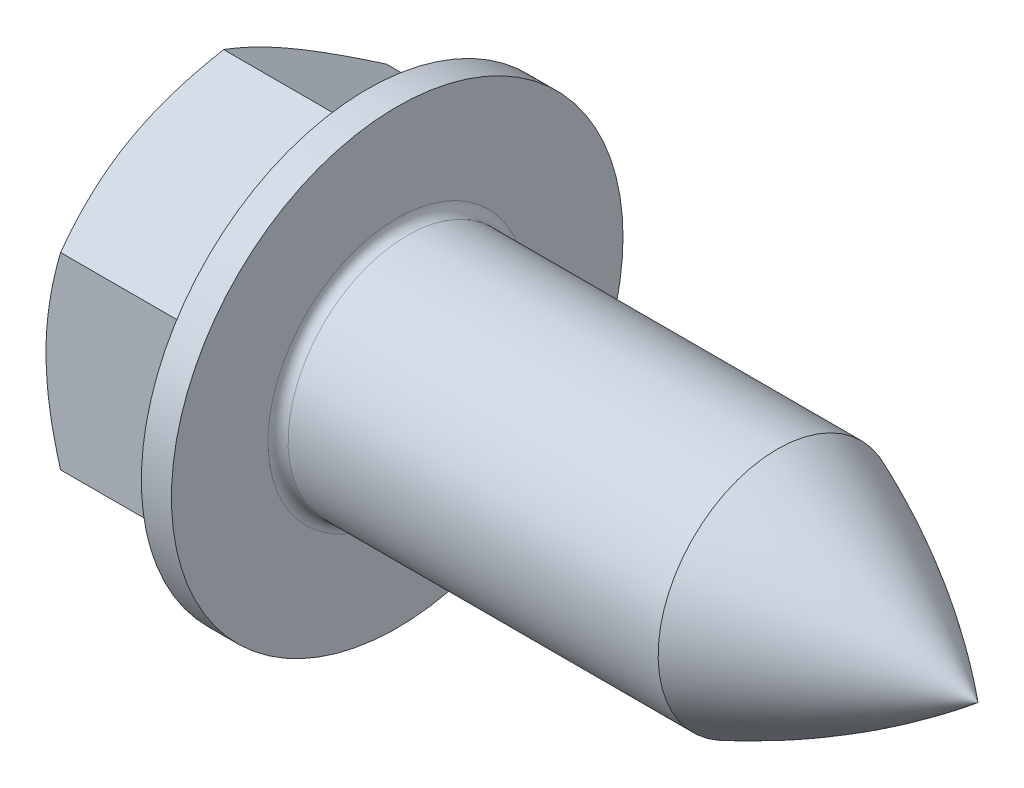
SolidWorks part; units mm, degrees
ref_plane "Front" through (0, 0, 0) normal (0, 0, 1) x (1, 0, 0)
ref_plane "Top" through (0, 0, 0) normal (0, 1, 0) x (1, 0, 0)
ref_plane "Right" through (0, 0, 0) normal (1, 0, 0) x (0, 0, -1)
sketch "Sketch2" plane through (0, 0, 0) normal (1, 0, 0) x (0, 0, -1)
  line L1 (0, 7.5056) -> (-6.5, 3.7528)
  line L2 (-6.5, 3.7528) -> (-6.5, -3.7528)
  line L3 (-6.5, -3.7528) -> (0, -7.5056)
  line L4 (0, -7.5056) -> (6.5, -3.7528)
  line L5 (6.5, -3.7528) -> (6.5, 3.7528)
  line L6 (6.5, 3.7528) -> (0, 7.5056)
  circle A0 centre (0, 0) radius 6.5 construction
  dimension "s" = 13
extrude "BaseHead" add sketch "Sketch2" along normal blind 7.5
sketch "Sketch1" plane through (0, 0, 0) normal (0, 0, 1) x (1, 0, 0)
  line L0 (-9.5445, 0) -> (41.9665, 0) construction
  line L1 (30.65, 0) -> (30.65, 4.75)
  line L2 (30.65, 4.75) -> (7.5, 4.75)
  line L3 (7.5, 4.75) -> (7.5, 0)
  line L4 (30.65, 0) -> (7.5, 0)
  line L5 (7.5, 3.7528) -> (7.5, -3.7528) construction
  line L6 (9.6, 7.9501) -> (9.6, -3.7754) construction
  dimension "st" = 9.5
  dimension "l" = 23.15
  dimension "a" = 2.1
revolve "BaseBody" add sketch "Sketch1" angle 360 about L0
sketch "Sketch3" plane through (7.5, -3.7817, 4.2127) normal (1, 0, 0) x (0, 0, -1)
  circle A0 centre (4.2127, 3.7817) radius 9
  dimension "dc" = 18
extrude "Neck" add sketch "Sketch3" against normal blind 1.2
sketch "Sketch4" plane through (0, 0, 0) normal (0, 0, 1) x (1, 0, 0)
  line L0 (10.6638, 0) -> (-1.5125, 0) construction
  line L2 (0, 6.5) -> (0.5806, 7.5056)
  line L5 (0.5806, 7.5056) -> (0, 7.5056)
  line L6 (0, 7.5056) -> (0, 6.5)
  dimension "D1" = 13
  dimension "D2" = 30
revolve "Cut-Revolve7" cut sketch "Sketch4" angle 360 about L0
fillet "Fillet1" radius 0.4 1 edges at (7.5, 0, 4.75)
fillet "Fillet2" radius 0.6 6 edges at (6.3, -5.6292, -3.25) (6.3, -5.6292, 3.25) (6.3, 0, 6.5) (6.3, 5.6292, 3.25) (6.3, 5.6292, -3.25) (6.3, 0, -6.5)
sketch "Sketch5" plane through (0, 0, 0) normal (0, 0, 1) x (1, 0, 0)
  line L0 (31.9782, 0) -> (17.0112, 0) construction
  line L2 (26.45, -4.75) -> (28.55, -4.75)
  line L3 (28.55, -4.75) -> (30.65, -4.225)
  line L5 (30.65, -4.75) -> (30.65, 4.75) construction
  line L6 (26.45, -4.75) -> (26.45, -5.25)
  line L7 (26.45, -5.25) -> (30.65, -5.25)
  line L8 (30.65, -5.25) -> (30.65, -4.225)
  point P15 (28.55, -4.75)
  dimension "D1" = 9.5
  dimension "yf" = 4.2
  dimension "D2" = 2.1
  dimension "D3" = 0.525
  dimension "D4" = 0.5
revolve "Cut-Revolve1" cut sketch "Sketch5" angle 360 about L0
sketch "Sketch6" plane through (0, 0, 0) normal (0, 0, 1) x (1, 0, 0)
  line L0 (33.3907, 0) -> (10.0621, 0) construction
  line L2 (30.65, -4.75) -> (30.65, 4.75) construction
  line L3 (30.65, 0) -> (22.65, -4.75) construction
  line L6 (30.65, 0) -> (31.15, 0)
  line L7 (22.65, -4.75) -> (30.65, -4.75)
  line L8 (31.15, 0) -> (31.15, -4.75)
  line L9 (31.15, -4.75) -> (30.65, -4.75)
  arc A0 (30.65, 0) -> (22.65, -4.75) centre (10.4863, 24.8481) cw
  dimension "D1" = 32
  dimension "D2" = 0.5
  dimension "yc" = 8
  dimension "D3" = 9.5
revolve "Cut-Revolve6" cut sketch "Sketch6" angle 360 about L0
sketch "Sketch7" plane through (0, 0, 0) normal (0, 0, 1) x (1, 0, 0)
  line L0 (0, 0) -> (-5.4653, 0) construction
  line L1 (-0.1, 5.4167) -> (0.9, 5.4167)
  line L2 (-0.1, 5.4167) -> (-0.1, 0)
  line L3 (-0.1, 0) -> (1.15, 0)
  line L4 (1.15, 5.1667) -> (1.15, 0)
  arc A0 (0.9, 5.4167) -> (1.15, 5.1667) centre (0.9, 5.1667) cw
  point P9 (1.15, 5.4167)
  dimension "D4" = 0.25
  dimension "D1" = 0.1
  dimension "D2" = 10.8333
  dimension "D3" = 1.25
revolve "Cut-Revolve8" cut sketch "Sketch7" angle 360 about L0
sketch "Sketch8" plane through (0, 0, 0) normal (0, 0, 1) x (1, 0, 0)
  line L0 (9.35, 5.25) -> (9.85, 5.25)
  line L1 (9.85, 5.25) -> (9.85, 4.75)
  line L2 (9.85, 4.75) -> (9.6, 4.317)
  line L3 (9.6, 4.317) -> (9.35, 4.75)
  line L4 (9.35, 4.75) -> (9.35, 5.25)
  line L5 (0, 0) -> (32.2552, 0) construction
  line L6 (7.5, -9) -> (7.5, 9) construction
  dimension "D1" = 9.5
  dimension "D2" = 0.5
  dimension "D3" = 2.1
revolve "Cut-Revolve10" [suppressed] cut sketch "Sketch8" angle 360 about L5
pattern_linear "LPattern10" [suppressed] count 35 spacing 0.6 along (1, 0, 0)
equation "\"D3@Sketch5\" = \"yf@Sketch5\" / 8"
equation "\"D2@ThreadCosmetic1\" = \"st@Sketch1\" - 1"
equation "\"D1@Sketch6\" = \"yc@Sketch6\" * 4"
equation "\"D3@Sketch6\" = \"st@Sketch1\""
equation "\"D2@Sketch5\" = \"yf@Sketch5\" / 2"
equation "\"D1@Sketch4\" = \"s@Sketch2\""
equation "\"D1@Sketch5\" = \"st@Sketch1\""
equation "\"D1@ThreadCosmetic1\" = \"l@Sketch1\" - \"a@Sketch1\""
equation "\"D2@Sketch7\" = \"s@Sketch2\" * 5 / 6"
equation "\"D3@Sketch7\" = \"k@BaseHead\" / 6"
equation "\"D4@Sketch7\" = \"D3@Sketch7\" / 5"
equation "\"D1@Sketch8\" = \"st@Sketch1\""
equation "\"D2@Sketch8\" =  ( \"st@Sketch1\" - \"D2@ThreadCosmetic1\" )  / 2"
equation "\"D3@Sketch8\" = \"a@Sketch1\""
equation "\"D3@LPattern10\" = \"D2@Sketch8\" * 1.2"
equation "\"D1@LPattern10\" = \"D1@ThreadCosmetic1\" / \"D3@LPattern10\""
